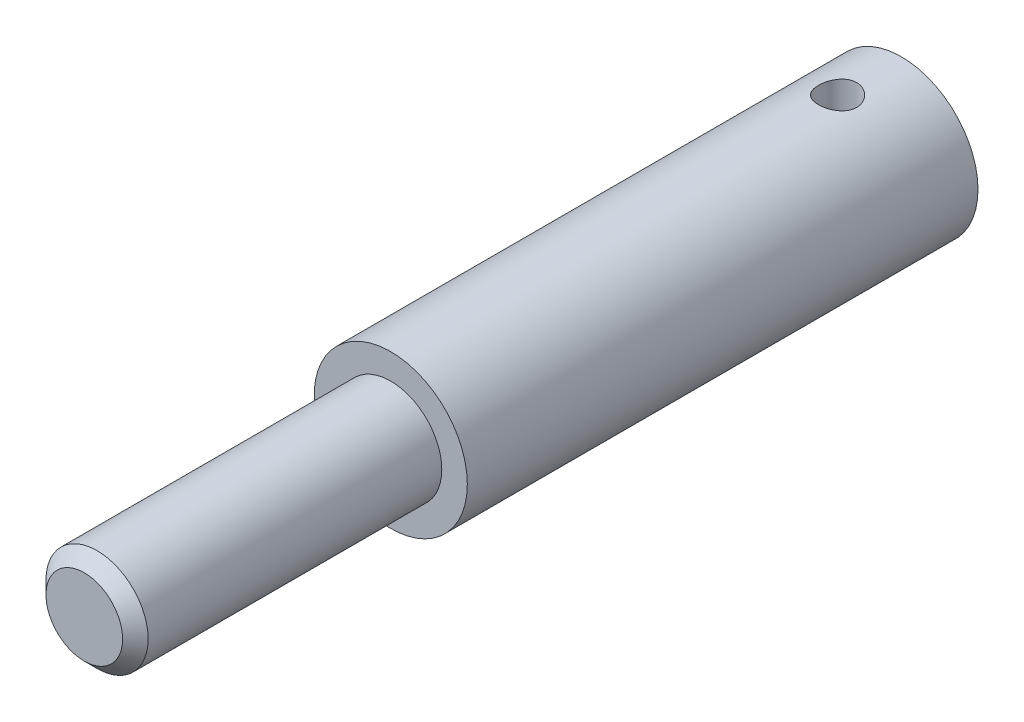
SolidWorks part; units mm, degrees
ref_plane "Face" through (0, 0, 0) normal (0, 0, 1) x (1, 0, 0)
ref_plane "Dessus" through (0, 0, 0) normal (0, 1, 0) x (1, 0, 0)
ref_plane "Droite" through (0, 0, 0) normal (1, 0, 0) x (0, 0, -1)
sketch "Esquisse1" plane through (0, 0, 0) normal (0, 0, 1) x (1, 0, 0)
  circle A0 centre (0, 0) radius 6
  dimension "D1" = 12
extrude "Extrusion1" add sketch "Esquisse1" along normal blind 40
sketch "Esquisse2" plane through (0, 0, 40) normal (0, 0, 1) x (1, 0, 0)
  circle A0 centre (0, 0) radius 4
  dimension "D1" = 8
extrude "Extrusion2" add sketch "Esquisse2" along normal blind 24
chamfer "Chanfrein1" distance 1 angle 45 1 edges at (4, 0, 64)
sketch "Esquisse3" plane through (0, 0, 0) normal (0, 1, 0) x (1, 0, 0)
  line L0 (6, 0) -> (-6, 0) construction
  circle A0 centre (0, -5) radius 1.5
  dimension "D1" = 3
  dimension "D2" = 5
extrude "Enlèv. mat.-Extru.1" cut sketch "Esquisse3" against normal mid plane 22
